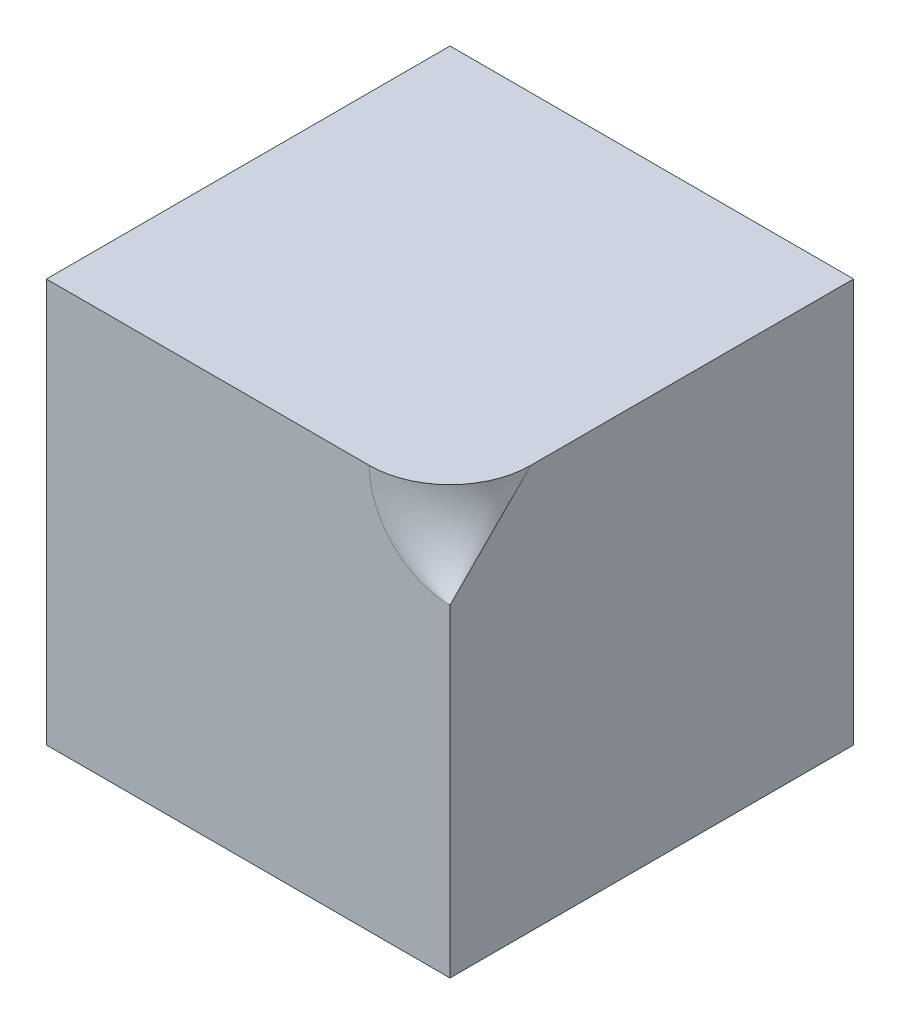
SolidWorks part; units mm, degrees
ref_plane "Ebene vorne" through (0, 0, 0) normal (0, 0, 1) x (1, 0, 0)
ref_plane "Ebene oben" through (0, 0, 0) normal (0, 1, 0) x (1, 0, 0)
ref_plane "Ebene rechts" through (0, 0, 0) normal (1, 0, 0) x (0, 0, -1)
sketch "Skizze1" plane through (0, 0, 0) normal (0, 0, 1) x (1, 0, 0)
  line L1 (-50, -50) -> (50, -50)
  line L2 (-50, -50) -> (-50, 50)
  line L3 (-50, 50) -> (50, 50)
  line L4 (50, -50) -> (50, 50)
  line L5 (-50, -50) -> (50, 50) construction
  line L6 (-50, 50) -> (50, -50) construction
  point P0 (0, 0)
  dimension "D1" = 100
extrude "Aufsatz-Linear austragen1" add sketch "Skizze1" along normal blind 100
sketch "Skizze6" plane through (0, 50, 0) normal (0, 1, 0) x (-1, 0, 0)
  line L0 (-50, 100) -> (50, 100) construction
  line L1 (-50, 100) -> (-50, 0) construction
  line L2 (-50, 80) -> (-30, 80) construction
  line L3 (-30, 80) -> (-30, 100) construction
  line L4 (-30, 100) -> (-50, 100)
  line L5 (-50, 100) -> (-50, 80)
  arc A0 (-30, 100) -> (-50, 80) centre (-30, 80) ccw
  dimension "D1" = 20
sketch "Skizze7" plane through (0, 0, 100) normal (0, 0, 1) x (1, 0, 0)
  line L0 (50, 30) -> (50, 50) construction
  line L1 (50, 50) -> (30, 50) construction
  arc A0 (30, 50) -> (50, 30) centre (50, 50) ccw
sketch "Skizze8" plane through (50, 0, 0) normal (1, 0, 0) x (0, 0, -1)
  line L0 (-100, 30) -> (-80, 50)
sketch "Skizze9" plane through (50, 0, 0) normal (1, 0, 0) x (0, 0, -1)
  point P0 (-100, 30)
loft "Schnitt-Ausformung1" cut profiles "Skizze6", "Skizze9"
